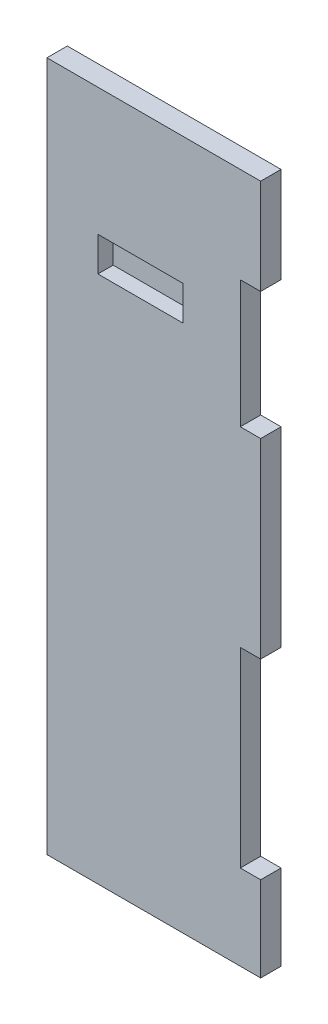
SolidWorks part; units mm, degrees
ref_plane "Front Plane" through (0, 0, 0) normal (0, 0, 1) x (1, 0, 0)
ref_plane "Top Plane" through (0, 0, 0) normal (0, 1, 0) x (1, 0, 0)
ref_plane "Right Plane" through (0, 0, 0) normal (1, 0, 0) x (0, 0, -1)
sketch "Sketch1" plane through (0, 0, 0) normal (0, 0, 1) x (1, 0, 0)
  line L0 (237.1989, 618) -> (237.1989, 543) construction
  line L2 (0, 76.2) -> (0, 618)
  line L3 (0, 618) -> (167.8, 618)
  line L4 (167.8, 76.2) -> (167.8, 143)
  line L5 (164.5597, 443) -> (164.5597, 293) construction
  line L6 (167.8, 543) -> (151.8, 543)
  line L7 (83.9, 618) -> (83.9, 76.2) construction
  line L8 (167.8, 443) -> (151.8, 443)
  line L9 (151.8, 543) -> (151.8, 443)
  line L10 (167.8, 293) -> (167.8, 443)
  line L11 (167.8, 293) -> (151.8, 293)
  line L12 (167.8, 543) -> (167.8, 618)
  line L13 (167.8, 143) -> (151.8, 143)
  line L14 (151.8, 293) -> (151.8, 143)
  line L15 (167.8, 76.2) -> (0, 76.2)
extrude "Boss-Extrude1" add sketch "Sketch1" along normal blind 16
sketch "Sketch3" plane through (0, 0, 16) normal (0, 0, 1) x (1, 0, 0)
  line L0 (0, 584.6819) -> (40, 584.6819) construction
  line L1 (0, 76.2) -> (0, 618) construction
  line L2 (40, 618) -> (40, 518) construction
  line L3 (0, 618) -> (167.8, 618) construction
  line L5 (40, 518) -> (107, 518)
  line L6 (40, 518) -> (40, 491)
  line L7 (40, 491) -> (107, 491)
  line L8 (107, 518) -> (107, 491)
  dimension "D1" = 40
  dimension "D2" = 100
  dimension "D3" = 27
  dimension "D4" = 67
extrude "Cut-Extrude1" cut sketch "Sketch3" against normal blind 12
sketch "Sketch4" plane through (0, 0, 4) normal (0, 0, 1) x (1, 0, 0)
  line L1 (107, 518) -> (64, 518)
  line L2 (107, 518) -> (107, 514)
  line L3 (107, 514) -> (64, 514)
  line L4 (64, 518) -> (64, 514)
  dimension "D1" = 43
  dimension "D2" = 4
extrude "Cut-Extrude2" cut sketch "Sketch4" against normal blind 6 contours L3 L4 L1 L2
equation "\"thk\"= 16mm"
equation "\"D4@Sketch1\"=\"thk\""
equation "\"D7@Sketch1\"=\"thk\""
equation "\"D1@Boss-Extrude1\"=\"thk\""
